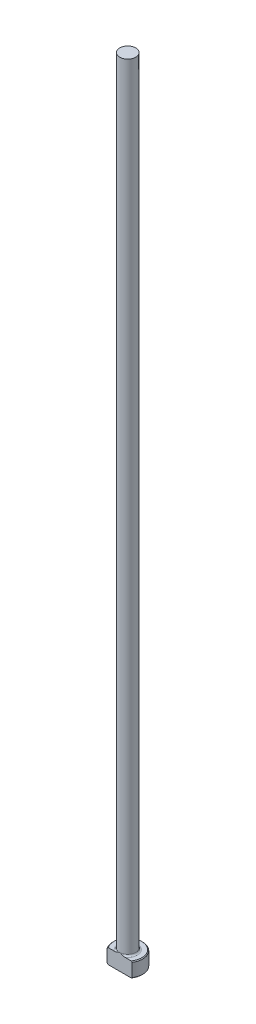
SolidWorks part; units mm, degrees
ref_plane "Front Plane" through (0, 0, 0) normal (0, 0, 1) x (1, 0, 0)
ref_plane "Top Plane" through (0, 0, 0) normal (0, 1, 0) x (1, 0, 0)
ref_plane "Right Plane" through (0, 0, 0) normal (1, 0, 0) x (0, 0, -1)
sketch "Sketch1" plane through (0, 0, 0) normal (0, 0, 1) x (1, 0, 0)
  line L0 (0, 259.9588) -> (0, -15.1925) construction
  line L1 (0, 0) -> (-4.7625, 0)
  line L2 (-4.7625, 0) -> (-4.7625, 4.7498)
  line L3 (-4.7625, 4.7498) -> (-2.5794, 4.7498)
  line L4 (-2.5794, 4.7498) -> (-2.5794, 254)
  line L5 (-2.5794, 254) -> (0, 254)
  line L6 (0, 254) -> (0, 0)
  dimension "L" = 254
  dimension "H" = 9.525
  dimension "T" = 4.7498
  dimension "D" = 5.1587
revolve "Revolve1" add sketch "Sketch1" angle 360 about L0
chamfer "Chamfer1" distance 0.254 angle 45 2 edges at (0, 4.7498, 4.7625) (0, 0, 4.7625)
fillet "Fillet1" radius 0.508 1 edges at (0, 4.7498, 2.5794)
sketch "Sketch2" plane through (0, 0, 0) normal (0, 1, 0) x (1, 0, 0)
  line L0 (-4.0035, -2.5794) -> (4.0035, -2.5794)
  circle A0 centre (0, 0) radius 4.7625 construction
  arc A1 (-4.0035, -2.5794) -> (4.0035, -2.5794) centre (0, 0) ccw
  circle A3 centre (0, 0) radius 2.5794 construction
  dimension "D1" = 0
extrude "Key" cut sketch "Sketch2" along normal through all
sketch "Pocket Sketch" plane through (0, 0, 0) normal (0, 0, 1) x (1, 0, 0)
  line L0 (-5.1594, 0) -> (-5.1594, 4.7752)
  line L1 (-5.1594, 4.7752) -> (-3.5398, 4.7752)
  line L2 (-2.7778, 5.5372) -> (-2.7778, 22.225)
  line L3 (-2.7778, 22.225) -> (0, 22.225)
  line L4 (0, 22.225) -> (0, 0)
  line L5 (0, 0) -> (-5.1594, 0)
  line L6 (0, 12.6104) -> (0, -2.4989) construction
  line L7 (-4.7625, 4.4958) -> (-4.7625, 0.254) construction
  line L8 (4.5085, 4.7498) -> (-4.5085, 4.7498) construction
  line L9 (-2.5794, 254) -> (-2.5794, 5.2578) construction
  line L10 (-3.5398, 4.7752) -> (-2.7778, 5.5372)
  point P3 (-2.7778, 4.7752)
  dimension "D1" = 10.3187
  dimension "D2" = 0.3969
  dimension "D3" = 0.0254
  dimension "D4" = 0.1984
  dimension "D5" = 5.5556
  dimension "D6" = 22.225
